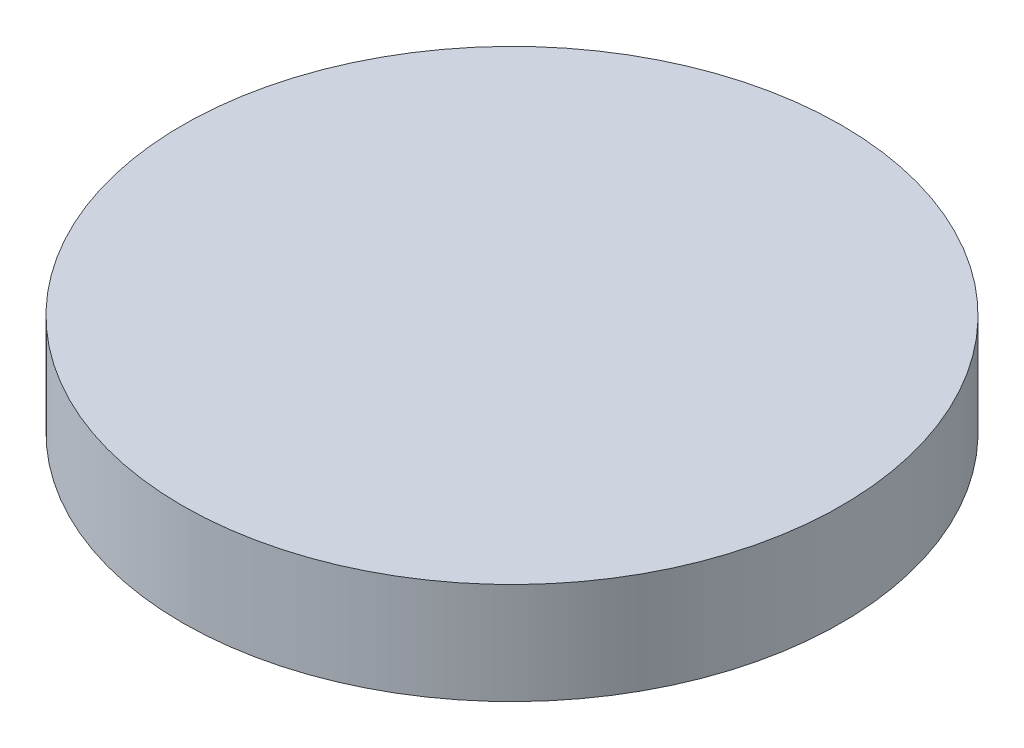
SolidWorks part; units mm, degrees
ref_plane "Alzado" through (0, 0, 0) normal (0, 0, 1) x (1, 0, 0)
ref_plane "Planta" through (0, 0, 0) normal (0, 1, 0) x (1, 0, 0)
ref_plane "Vista lateral" through (0, 0, 0) normal (1, 0, 0) x (0, 0, -1)
sketch "Croquis1" plane through (0, 0, 0) normal (0, 1, 0) x (1, 0, 0)
  circle A0 centre (0, 0) radius 39
  dimension "D1" = 78
extrude "Saliente-Extruir1" add sketch "Croquis1" along normal blind 12
